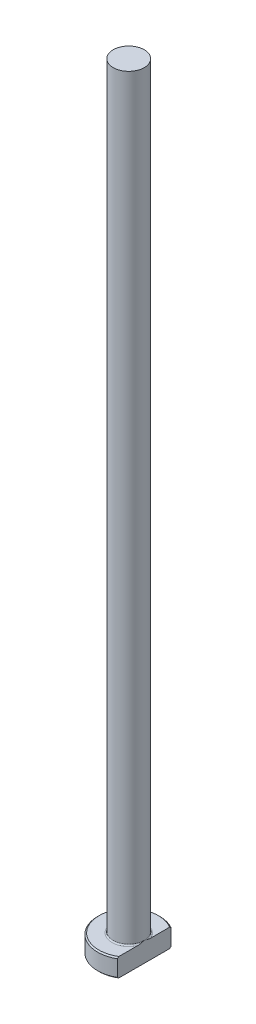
SolidWorks part; units mm, degrees
ref_plane "Front Plane" through (0, 0, 0) normal (0, 0, 1) x (1, 0, 0)
ref_plane "Top Plane" through (0, 0, 0) normal (0, 1, 0) x (1, 0, 0)
ref_plane "Right Plane" through (0, 0, 0) normal (1, 0, 0) x (0, 0, -1)
sketch "Sketch1" plane through (0, 0, 0) normal (0, 0, 1) x (1, 0, 0)
  line L0 (0, 259.9588) -> (0, -15.1925) construction
  line L1 (0, 0) -> (-5, 0)
  line L2 (-5, 0) -> (-5, 3)
  line L3 (-5, 3) -> (-2.5, 3)
  line L4 (-2.5, 3) -> (-2.5, 125)
  line L5 (-2.5, 125) -> (0, 125)
  line L6 (0, 125) -> (0, 0)
  dimension "L" = 125
  dimension "H" = 10
  dimension "T" = 3
  dimension "D" = 5
revolve "Revolve1" add sketch "Sketch1" angle 360 about L0
chamfer "Chamfer1" distance 0.2 angle 45 2 edges at (0, 3, 5) (0, 0, 5)
fillet "Fillet1" radius 0.2 1 edges at (0, 3, 2.5)
sketch "Sketch2" plane through (0, 0, 0) normal (0, 1, 0) x (1, 0, 0)
  line L0 (2.5, 4.3301) -> (2.5, -4.3301)
  circle A0 centre (0, 0) radius 5 construction
  arc A1 (2.5, -4.3301) -> (2.5, 4.3301) centre (0, 0) ccw
  circle A2 centre (0, 0) radius 2.5 construction
extrude "KEY" cut sketch "Sketch2" along normal through all
